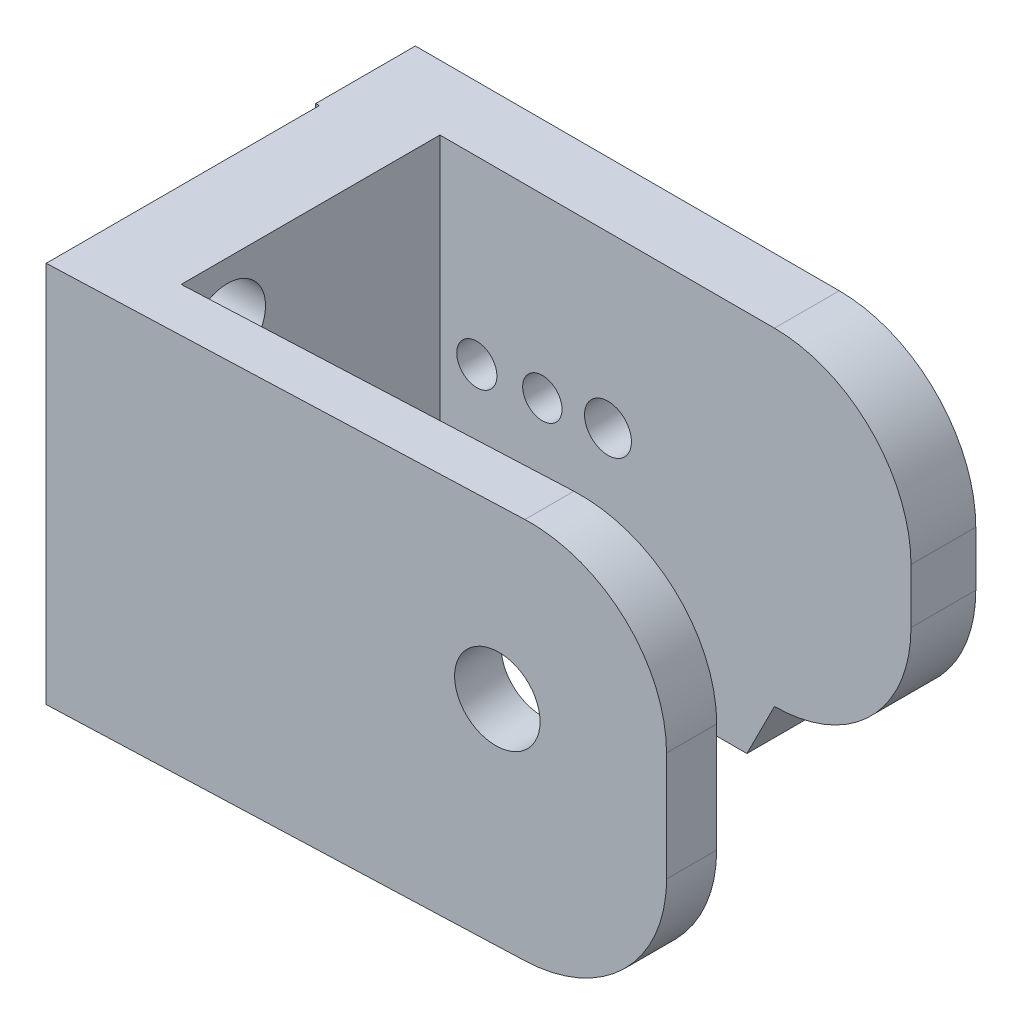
SolidWorks part; units mm, degrees
ref_plane "Front Plane" through (0, 0, 0) normal (0, 0, 1) x (1, 0, 0)
ref_plane "Top Plane" through (0, 0, 0) normal (0, 1, 0) x (1, 0, 0)
ref_plane "Right Plane" through (0, 0, 0) normal (1, 0, 0) x (0, 0, -1)
sketch "Sketch1" plane through (0, 0, 0) normal (0, 1, 0) x (1, 0, 0)
  line L1 (-35.9593, 3.6497) -> (-15.4305, 3.6497)
  line L2 (-35.9593, 3.6497) -> (-35.9593, 0)
  line L3 (-35.9593, 0) -> (-15.4305, 0)
  line L4 (-15.4305, 3.6497) -> (-15.4305, 0)
  dimension "D1" = 3.6497
extrude "Boss-Extrude1" add sketch "Sketch1" along normal blind 10 and the other way blind 2
sketch "Sketch2" plane through (0, 0, -3.6497) normal (0, 0, -1) x (-1, 0, 0)
  line L0 (21.2445, 8.1746) -> (37.7283, 5.8087)
  line L1 (37.7283, 5.8087) -> (37.7283, 0.6135)
  line L2 (37.7283, 0.6135) -> (20.688, 0.3804)
  arc A0 (21.2445, 8.1746) -> (20.688, 0.3804) centre (20.688, 4.2973) ccw
extrude "Cut-Extrude1" cut sketch "Sketch2" against normal blind 1
sketch "Sketch3" plane through (0, 0, -2.6497) normal (0, 0, -1) x (-1, 0, 0)
  circle A0 centre (31.3337, 3.397) radius 0.7359
  circle A1 centre (28.9339, 3.5314) radius 0.721
  circle A2 centre (26.5288, 3.7756) radius 0.8587
extrude "Cut-Extrude2" cut sketch "Sketch3" against normal blind 6
sketch "Sketch4" plane through (0, 10, 0) normal (0, 1, 0) x (1, 0, 0)
  line L1 (-14.98, -1.2867) -> (-32.718, -1.2867)
  line L2 (-14.98, -1.2867) -> (-14.98, 1.2752)
  line L3 (-14.98, 1.2752) -> (-32.718, 1.2752)
  line L4 (-32.718, -1.2867) -> (-32.718, 1.2752)
extrude "Cut-Extrude3" cut sketch "Sketch4" against normal blind 18
sketch "Sketch5" plane through (0, 10, 0) normal (0, 1, 0) x (1, 0, 0)
  line L0 (-32.6861, -3.68) -> (-32.6861, -8.2028)
  line L1 (-35.828, 1.2752) -> (-32.6861, 1.2752)
  line L2 (-35.828, 1.2752) -> (-35.828, -3.68)
  line L4 (-32.6861, 1.2752) -> (-32.6861, -3.68)
  line L5 (-32.6861, -8.2028) -> (-13.9315, -7.3411)
  line L6 (-13.9315, -7.3411) -> (-13.9315, -9.178)
  line L7 (-13.9315, -9.178) -> (-35.828, -10.0042)
  line L8 (-35.828, -10.0042) -> (-35.828, -3.68)
extrude "Boss-Extrude2" add sketch "Sketch5" against normal blind 14
sketch "Sketch6" plane through (-32.6861, 0, 0) normal (1, 0, 0) x (0, 0, -1)
  circle A0 centre (-6.5131, 7.7835) radius 1.4
  circle A1 centre (-0.513, 0.1383) radius 1.4
  dimension "D1" = 2.8
  dimension "D2" = 2.8
extrude "Cut-Extrude4" cut sketch "Sketch6" against normal blind 12
sketch "Sketch7" plane through (0.326, 0, 8.64) normal (0.0377, 0, 0.9993) x (0.9993, 0, -0.0377)
  circle A0 centre (-20.2443, 3.8406) radius 1.5095
extrude "Cut-Extrude5" cut sketch "Sketch7" against normal blind 9
fillet "Fillet2" radius 5 4 edges at (-15.4305, -2, -2.4625) (-15.4305, 10, -2.4625) (-13.9315, -4, 8.2595) (-13.9315, 10, 8.2595)
sketch "Sketch8" plane through (0, 0, -1.2752) normal (0, 0, -1) x (-1, 0, 0)
  line L0 (35.828, -4) -> (21.4404, -4)
  line L1 (18.9315, -4) -> (32.6861, -4) construction
  line L2 (21.4404, -4) -> (20.4305, -2)
  line L3 (20.4305, -2) -> (35.9593, -1.1784)
  line L4 (35.9593, -2) -> (35.9593, 0.5893) construction
  line L5 (35.9593, -1.1784) -> (35.828, -2)
  line L6 (35.828, -2) -> (35.828, -4)
  arc A0 (15.4305, 3) -> (20.4305, -2) centre (20.4305, 3) ccw construction
extrude "Boss-Extrude3" add sketch "Sketch8" along normal blind 2.2
